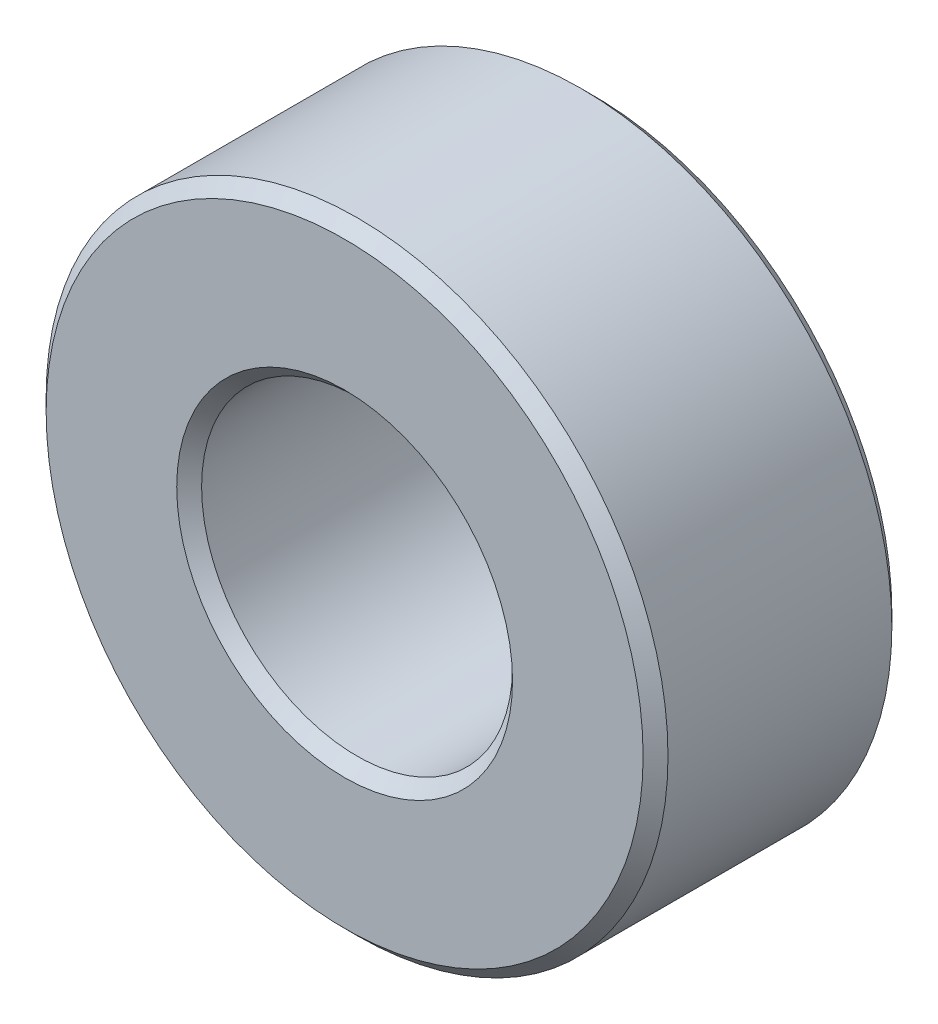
SolidWorks part; units mm, degrees
ref_plane "Front Plane" through (0, 0, 0) normal (0, 0, 1) x (1, 0, 0)
ref_plane "Top Plane" through (0, 0, 0) normal (0, 1, 0) x (1, 0, 0)
ref_plane "Right Plane" through (0, 0, 0) normal (1, 0, 0) x (0, 0, -1)
sketch "Sketch1" plane through (0, 0, 0) normal (0, 0, 1) x (1, 0, 0)
  circle A0 centre (0, 0) radius 2.5
  circle A1 centre (0, 0) radius 1.25
  dimension "D1" = 5
  dimension "D2" = 2.5
extrude "Boss-Extrude2" add sketch "Sketch1" along normal mid plane 2
chamfer "Chamfer3" distance 0.1 angle 45 4 edges at (2.5, 0, 1) (2.5, 0, -1) (1.25, 0, -1) (1.25, 0, 1)
